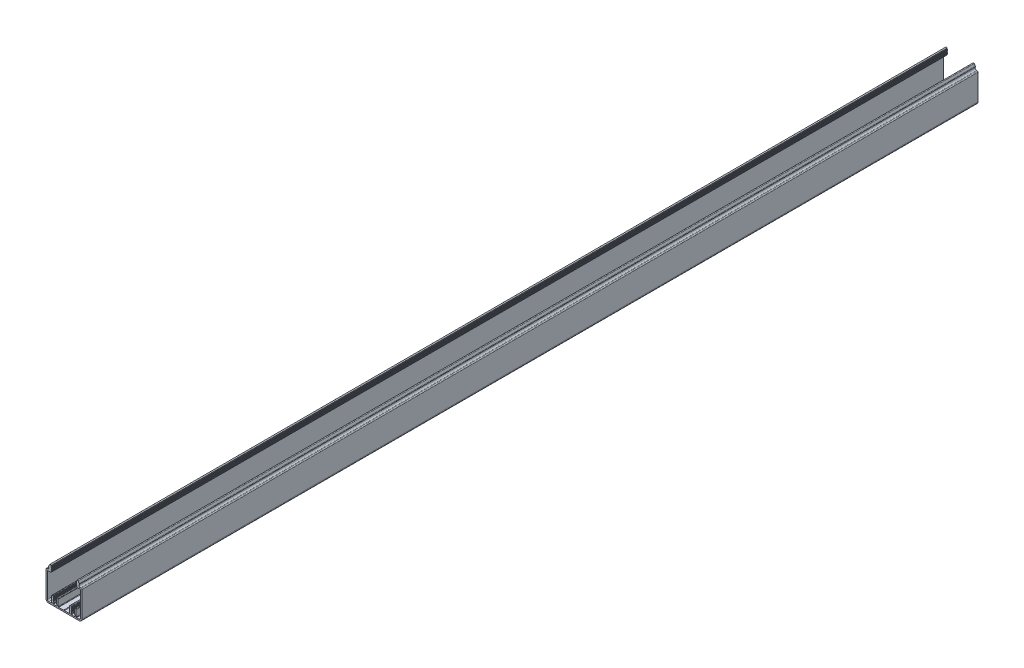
SolidWorks part; units mm, degrees
ref_plane "Ebene vorne" through (0, 0, 0) normal (0, 0, 1) x (1, 0, 0)
ref_plane "Ebene oben" through (0, 0, 0) normal (0, 1, 0) x (1, 0, 0)
ref_plane "Ebene rechts" through (0, 0, 0) normal (1, 0, 0) x (0, 0, -1)
sketch "Model" plane through (0, 0, 0) normal (0, 0, 1) x (1, 0, 0)
  line L134 (153.6658, -4.2821) -> (153.6658, -3.7877)
  line L135 (155.0687, -3.4118) -> (156.2252, -5.4148)
  line L136 (157.5091, -8.8359) -> (158.1591, -8.8359)
  line L137 (127.0091, -32.1859) -> (127.5591, -32.5034)
  line L138 (127.5591, -32.5034) -> (127.5591, -33.2684)
  line L139 (127.5591, -33.2684) -> (127.0091, -33.5859)
  line L140 (127.0091, -33.5859) -> (127.5591, -33.9034)
  line L141 (127.5591, -33.9034) -> (127.5591, -34.6684)
  line L142 (127.5591, -34.6684) -> (127.0091, -34.9859)
  line L143 (127.0091, -34.9859) -> (127.5591, -35.3034)
  line L144 (127.5591, -35.3034) -> (127.5591, -36.0683)
  line L145 (127.5591, -36.0683) -> (127.0091, -36.3859)
  line L146 (127.0091, -36.3859) -> (127.5591, -36.7034)
  line L147 (127.5591, -36.7034) -> (127.5591, -37.4683)
  line L148 (127.5591, -37.4683) -> (127.0091, -37.7859)
  line L149 (127.0091, -37.7859) -> (127.0091, -39.3359)
  line L150 (130.7591, -32.3359) -> (130.7591, -32.5684)
  line L151 (130.7591, -32.5684) -> (131.3091, -32.8859)
  line L152 (131.3091, -32.8859) -> (130.7591, -33.2034)
  line L153 (130.7591, -33.2034) -> (130.7591, -33.9684)
  line L154 (130.7591, -33.9684) -> (131.3091, -34.2859)
  line L155 (131.3091, -34.2859) -> (130.7591, -34.6034)
  line L156 (130.7591, -34.6034) -> (130.7591, -35.3683)
  line L157 (130.7591, -35.3683) -> (131.3091, -35.6859)
  line L158 (131.3091, -35.6859) -> (130.7591, -36.0034)
  line L159 (130.7591, -36.0034) -> (130.7591, -36.7683)
  line L160 (130.7591, -36.7683) -> (131.3091, -37.0859)
  line L161 (131.3091, -37.0859) -> (130.7591, -37.4034)
  line L162 (130.7591, -37.4034) -> (130.7591, -38.1683)
  line L163 (130.7591, -38.1683) -> (131.3091, -38.4859)
  line L164 (131.3091, -38.4859) -> (131.3091, -39.3359)
  line L165 (127.5091, -39.8359) -> (130.8091, -39.8359)
  line L166 (125.5091, -32.3359) -> (125.5091, -39.3359)
  line L167 (132.8091, -32.3359) -> (132.8091, -39.3359)
  line L168 (126.0091, -31.8359) -> (127.0091, -31.8359)
  line L169 (131.2591, -31.8359) -> (132.3091, -31.8359)
  line L170 (127.0091, -32.1859) -> (127.0091, -31.8359)
  line L171 (151.3091, -32.1859) -> (150.7591, -32.5034)
  line L172 (150.7591, -32.5034) -> (150.7591, -33.2684)
  line L173 (150.7591, -33.2684) -> (151.3091, -33.5859)
  line L174 (151.3091, -33.5859) -> (150.7591, -33.9034)
  line L175 (150.7591, -33.9034) -> (150.7591, -34.6684)
  line L176 (150.7591, -34.6684) -> (151.3091, -34.9859)
  line L177 (151.3091, -34.9859) -> (150.7591, -35.3034)
  line L178 (150.7591, -35.3034) -> (150.7591, -36.0683)
  line L179 (150.7591, -36.0683) -> (151.3091, -36.3859)
  line L180 (151.3091, -36.3859) -> (150.7591, -36.7034)
  line L181 (150.7591, -36.7034) -> (150.7591, -37.4683)
  line L182 (150.7591, -37.4683) -> (151.3091, -37.7859)
  line L183 (151.3091, -37.7859) -> (151.3091, -39.3359)
  line L184 (147.5591, -32.3359) -> (147.5591, -32.5684)
  line L185 (147.5591, -32.5684) -> (147.0091, -32.8859)
  line L186 (147.0091, -32.8859) -> (147.5591, -33.2034)
  line L187 (147.5591, -33.2034) -> (147.5591, -33.9684)
  line L188 (147.5591, -33.9684) -> (147.0091, -34.2859)
  line L189 (147.0091, -34.2859) -> (147.5591, -34.6034)
  line L190 (147.5591, -34.6034) -> (147.5591, -35.3683)
  line L191 (147.5591, -35.3683) -> (147.0091, -35.6859)
  line L192 (147.0091, -35.6859) -> (147.5591, -36.0034)
  line L193 (147.5591, -36.0034) -> (147.5591, -36.7683)
  line L194 (147.5591, -36.7683) -> (147.0091, -37.0859)
  line L195 (147.0091, -37.0859) -> (147.5591, -37.4034)
  line L196 (147.5591, -37.4034) -> (147.5591, -38.1683)
  line L197 (147.5591, -38.1683) -> (147.0091, -38.4859)
  line L198 (147.0091, -38.4859) -> (147.0091, -39.3359)
  line L199 (150.8091, -39.8359) -> (147.5091, -39.8359)
  line L200 (152.8091, -32.3359) -> (152.8091, -39.3359)
  line L201 (145.5091, -32.3359) -> (145.5091, -39.3359)
  line L202 (152.3091, -31.8359) -> (151.3091, -31.8359)
  line L203 (147.0591, -31.8359) -> (146.0091, -31.8359)
  line L204 (151.3091, -32.1859) -> (151.3091, -31.8359)
  line L205 (153.66, -9.8864) -> (153.1091, -9.5684)
  line L206 (153.1091, -9.5684) -> (153.1091, -8.8034)
  line L207 (153.1091, -8.8034) -> (153.6591, -8.4859)
  line L208 (153.6591, -8.4859) -> (153.1091, -8.1684)
  line L209 (153.1091, -8.1684) -> (153.1091, -7.4034)
  line L210 (153.1091, -7.4034) -> (153.6591, -7.0859)
  line L211 (153.6591, -7.0859) -> (153.1091, -6.7684)
  line L212 (153.1091, -6.7684) -> (153.1091, -6.0035)
  line L213 (153.1091, -6.0035) -> (153.6591, -5.6859)
  line L214 (153.6591, -5.6859) -> (153.1091, -5.3684)
  line L215 (153.1091, -5.3684) -> (153.1091, -4.6035)
  line L216 (122.1591, -41.3359) -> (156.1591, -41.3359)
  line L217 (119.1591, -9.8359) -> (119.1591, -38.3359)
  line L218 (120.6591, -38.3359) -> (120.6591, -10.8359)
  line L219 (159.1591, -9.8359) -> (159.1591, -38.3359)
  line L220 (157.6591, -38.3359) -> (157.6591, -10.8359)
  line L221 (156.1591, -39.8359) -> (153.3091, -39.8359)
  line L222 (145.0091, -39.8359) -> (139.5055, -39.8359)
  line L223 (138.8127, -39.8359) -> (133.3091, -39.8359)
  line L224 (125.0091, -39.8359) -> (122.1591, -39.8359)
  line L225 (124.6582, -9.8864) -> (125.2091, -9.5683)
  line L226 (125.2091, -9.5683) -> (125.2091, -8.8034)
  line L227 (125.2091, -8.8034) -> (124.6591, -8.4859)
  line L228 (124.6591, -8.4859) -> (125.2091, -8.1683)
  line L229 (125.2091, -8.1683) -> (125.2091, -7.4034)
  line L230 (125.2091, -7.4034) -> (124.6591, -7.0859)
  line L231 (124.6591, -7.0859) -> (125.2091, -6.7684)
  line L232 (125.2091, -6.7684) -> (125.2091, -6.0034)
  line L233 (125.2091, -6.0034) -> (124.6591, -5.6859)
  line L234 (124.6591, -5.6859) -> (125.2091, -5.3684)
  line L235 (125.2091, -5.3684) -> (125.2091, -4.6034)
  line L236 (125.2091, -4.6034) -> (124.6525, -4.2821)
  line L237 (124.6582, -9.8864) -> (124.658, -10.3359)
  line L238 (124.658, -10.3359) -> (121.1591, -10.3359)
  line L239 (153.66, -9.8864) -> (153.6602, -10.3359)
  line L240 (153.6602, -10.3359) -> (157.1591, -10.3359)
  line L241 (124.6525, -4.2821) -> (124.6525, -3.7877)
  line L242 (123.2495, -3.4118) -> (122.0931, -5.4148)
  line L243 (120.8091, -8.8359) -> (120.1591, -8.8359)
  line L244 (153.1091, -4.6035) -> (153.6658, -4.2821)
  arc A35 (156.2023, -6.4525) -> (156.2252, -5.4148) centre (155.3591, -5.9148) ccw
  arc A36 (156.2023, -6.4525) -> (157.5091, -8.8359) centre (157.5091, -7.2859) ccw
  arc A37 (159.1591, -9.8359) -> (158.1591, -8.8359) centre (158.1591, -9.8359) ccw
  arc A38 (127.0091, -39.3359) -> (127.5091, -39.8359) centre (127.5091, -39.3359) ccw
  arc A39 (130.8091, -39.8359) -> (131.3091, -39.3359) centre (130.8091, -39.3359) ccw
  arc A40 (125.0091, -39.8359) -> (125.5091, -39.3359) centre (125.0091, -39.3359) ccw
  arc A41 (132.8091, -32.3359) -> (132.3091, -31.8359) centre (132.3091, -32.3359) ccw
  arc A42 (132.8091, -39.3359) -> (133.3091, -39.8359) centre (133.3091, -39.3359) ccw
  arc A43 (126.0091, -31.8359) -> (125.5091, -32.3359) centre (126.0091, -32.3359) ccw
  arc A44 (131.2591, -31.8359) -> (130.7591, -32.3359) centre (131.2591, -32.3359) ccw
  arc A45 (150.8091, -39.8359) -> (151.3091, -39.3359) centre (150.8091, -39.3359) ccw
  arc A46 (147.0091, -39.3359) -> (147.5091, -39.8359) centre (147.5091, -39.3359) ccw
  arc A47 (152.8091, -39.3359) -> (153.3091, -39.8359) centre (153.3091, -39.3359) ccw
  arc A48 (146.0091, -31.8359) -> (145.5091, -32.3359) centre (146.0091, -32.3359) ccw
  arc A49 (145.0091, -39.8359) -> (145.5091, -39.3359) centre (145.0091, -39.3359) ccw
  arc A50 (152.8091, -32.3359) -> (152.3091, -31.8359) centre (152.3091, -32.3359) ccw
  arc A51 (147.5591, -32.3359) -> (147.0591, -31.8359) centre (147.0591, -32.3359) ccw
  arc A52 (121.1591, -10.3359) -> (120.6591, -10.8359) centre (121.1591, -10.8359) ccw
  arc A53 (157.6591, -10.8359) -> (157.1591, -10.3359) centre (157.1591, -10.8359) ccw
  arc A54 (120.6591, -38.3359) -> (122.1591, -39.8359) centre (122.1591, -38.3359) ccw
  arc A55 (119.1591, -38.3359) -> (122.1591, -41.3359) centre (122.1591, -38.3359) ccw
  arc A56 (156.1591, -41.3359) -> (159.1591, -38.3359) centre (156.1591, -38.3359) ccw
  arc A57 (156.1591, -39.8359) -> (157.6591, -38.3359) centre (156.1591, -38.3359) ccw
  arc A58 (122.0931, -5.4148) -> (122.116, -6.4525) centre (122.9591, -5.9148) ccw
  arc A59 (120.8091, -8.8359) -> (122.116, -6.4525) centre (120.8091, -7.2859) ccw
  arc A60 (120.1591, -8.8359) -> (119.1591, -9.8359) centre (120.1591, -9.8359) ccw
  arc A61 (155.0687, -3.4118) -> (153.6658, -3.7877) centre (154.4176, -3.7877) ccw
  arc A62 (124.6525, -3.7877) -> (123.2495, -3.4118) centre (123.9006, -3.7877) ccw
  arc A63 (139.5055, -39.8359) -> (138.8127, -39.8359) centre (139.1591, -39.8859) ccw
extrude "Aufsatz-Linear austragen1" add sketch "Model" along normal blind 1000
